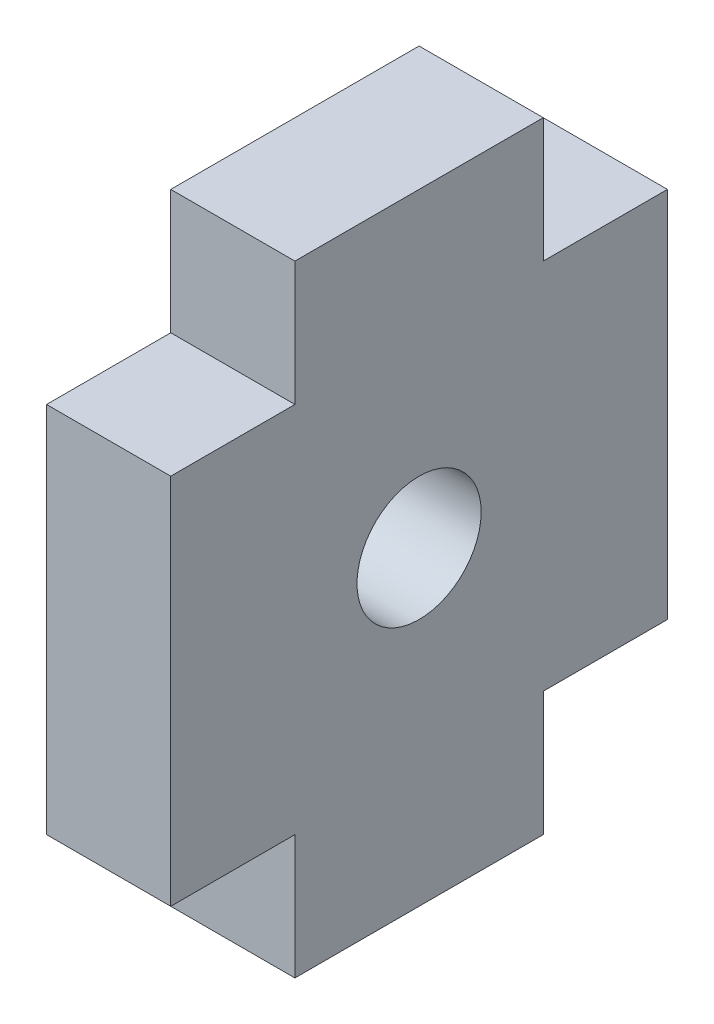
SolidWorks part; units mm, degrees
ref_plane "Front Plane" through (0, 0, 0) normal (0, 0, 1) x (1, 0, 0)
ref_plane "Top Plane" through (0, 0, 0) normal (0, 1, 0) x (1, 0, 0)
ref_plane "Right Plane" through (0, 0, 0) normal (1, 0, 0) x (0, 0, -1)
sketch "Sketch1" plane through (0, 0, 0) normal (1, 0, 0) x (0, 0, -1)
  line L0 (6.35, 9.525) -> (12.7, 9.525)
  line L1 (-12.7, 9.525) -> (-6.35, 9.525)
  line L2 (-12.7, 9.525) -> (-12.7, -9.525)
  line L3 (-12.7, -9.525) -> (-6.35, -9.525)
  line L4 (12.7, 9.525) -> (12.7, -9.525)
  line L5 (-12.7, 9.525) -> (12.7, -9.525) construction
  line L6 (-12.7, -9.525) -> (12.7, 9.525) construction
  line L7 (6.35, -9.525) -> (12.7, -9.525)
  line L8 (-6.35, 9.525) -> (-6.35, 15.875)
  line L9 (-6.35, 15.875) -> (6.35, 15.875)
  line L10 (6.35, 9.525) -> (6.35, 15.875)
  line L11 (0, 15.875) -> (0, -15.875) construction
  line L12 (-6.35, -9.525) -> (-6.35, -15.875)
  line L13 (-6.35, -15.875) -> (6.35, -15.875)
  line L14 (6.35, -9.525) -> (6.35, -15.875)
  circle A0 centre (0, 0) radius 3.175
  point P0 (0, 0)
  dimension "D5" = 6.35
  dimension "D1" = 25.4
  dimension "D2" = 6.35
  dimension "D3" = 19.05
  dimension "D4" = 12.7
extrude "Boss-Extrude1" add sketch "Sketch1" along normal mid plane 6.35
sketch "Sketch2" plane through (-3.175, 0, 0) normal (-1, 0, 0) x (0, 0, 1)
  line L24 (-12.8016, -9.6266) -> (-6.4516, -9.6266)
  line L25 (-6.4516, -9.6266) -> (-6.4516, -15.9766)
  line L26 (-6.4516, -15.9766) -> (6.4516, -15.9766)
  line L27 (6.4516, -15.9766) -> (6.4516, -9.6266)
  line L28 (6.4516, -9.6266) -> (12.8016, -9.6266)
  line L29 (12.8016, -9.6266) -> (12.8016, 9.6266)
  line L30 (12.8016, 9.6266) -> (6.4516, 9.6266)
  line L31 (6.4516, 9.6266) -> (6.4516, 15.9766)
  line L32 (6.4516, 15.9766) -> (-6.4516, 15.9766)
  line L33 (-6.4516, 15.9766) -> (-6.4516, 9.6266)
  line L34 (-6.4516, 9.6266) -> (-12.8016, 9.6266)
  line L35 (-12.8016, 9.6266) -> (-12.8016, -9.6266)
  line L36 (-12.8016, -9.6266) -> (-6.4516, -9.6266)
  line L37 (-6.4516, -9.6266) -> (-6.4516, -15.9766)
  line L38 (-6.4516, -15.9766) -> (6.4516, -15.9766)
  line L39 (6.4516, -15.9766) -> (6.4516, -9.6266)
  line L40 (6.4516, -9.6266) -> (12.8016, -9.6266)
  line L41 (12.8016, -9.6266) -> (12.8016, 9.6266)
  line L42 (12.8016, 9.6266) -> (6.4516, 9.6266)
  line L43 (6.4516, 9.6266) -> (6.4516, 15.9766)
  line L44 (6.4516, 15.9766) -> (-6.4516, 15.9766)
  line L45 (-6.4516, 15.9766) -> (-6.4516, 9.6266)
  line L46 (-6.4516, 9.6266) -> (-12.8016, 9.6266)
  line L47 (-12.8016, 9.6266) -> (-12.8016, -9.6266)
  circle A2 centre (0, 0) radius 2.921
  circle A3 centre (0, 0) radius 2.921
  dimension "D1" = 0.1016
  dimension "D2" = 0.254
